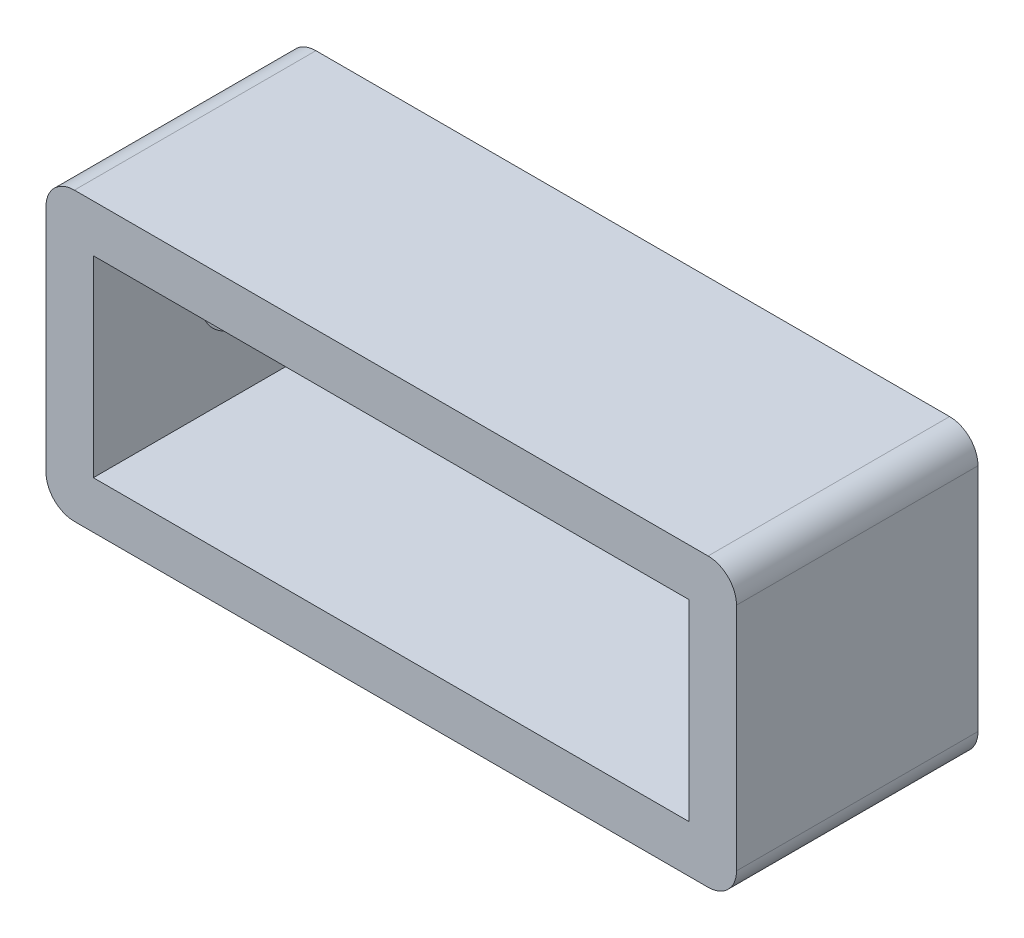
SolidWorks part; units mm, degrees
ref_plane "Front Plane" through (0, 0, 0) normal (0, 0, 1) x (1, 0, 0)
ref_plane "Top Plane" through (0, 0, 0) normal (0, 1, 0) x (1, 0, 0)
ref_plane "Right Plane" through (0, 0, 0) normal (1, 0, 0) x (0, 0, -1)
ref_plane "Plane1" through (0, 0, 0) normal (0, 0, -1) x (-1, 0, 0)
ref_plane "Plane2" through (0, 0, 3.8) normal (0, 0, -1) x (-1, 0, 0)
sketch "Sketch18" plane through (0, 0, 0) normal (0, 0, 1) x (1, 0, 0)
  line L1 (-23.75, 10) -> (4.75, 10)
  line L2 (-23.75, 10) -> (-23.75, -10)
  line L3 (-23.75, -10) -> (4.75, -10)
  line L4 (4.75, 10) -> (4.75, -10)
  line L5 (19.015, 8.6756) -> (31.985, 8.6756)
  line L6 (19.015, 8.6756) -> (19.015, -8.6756)
  line L7 (19.015, -8.6756) -> (31.985, -8.6756)
  line L8 (31.985, 8.6756) -> (31.985, -8.6756)
  line L11 (-35.9266, 0.5) -> (-35.9266, 33.5776)
  line L12 (0, 33.5776) -> (-35.9266, 33.5776)
  line L14 (-35.9266, 0.5) -> (-35.9266, -15)
  line L15 (-9.5, -15) -> (-35.9266, -15)
  line L16 (36.985, 0) -> (36.985, -15)
  line L17 (-9.5, -15) -> (36.985, -15)
  line L19 (-35.9266, 33.5776) -> (36.985, 33.5776)
  line L20 (-35.9266, 33.5776) -> (-35.9266, -15)
  line L21 (-35.9266, -15) -> (36.985, -15)
  line L22 (36.985, 33.5776) -> (36.985, -15)
  line L166 (31.985, -8.6756) -> (31.985, 8.6756)
  line L168 (19.015, 8.6756) -> (19.015, -8.6756)
  line L178 (4.75, 10) -> (-23.75, 10)
  line L190 (-23.75, -10) -> (4.75, -10)
  line L206 (4.75, -10) -> (4.75, 10)
  line L211 (-23.75, 10) -> (-23.75, -10)
  line L215 (31.985, -8.6756) -> (19.015, -8.6756)
  line L219 (19.015, 8.6756) -> (31.985, 8.6756)
  circle A0 centre (-17.9633, 25) radius 2.3
  circle A1 centre (10.5, 0.5) radius 1.4266
  circle A2 centre (-29.5, 0.5) radius 1.4266
  circle A4 centre (18.4925, 25) radius 2.3
extrude "Boss-Extrude1" add sketch "Sketch18" along normal blind 3 contours L22 L19 L12 L11 L14 L15 L17 L16 A4 A2 A1 A0 L1 L4 L3 L2 L5 L8 L7 L6
sketch "Sketch19" plane through (0, 0, 0) normal (0, 0, -1) x (-1, 0, 0)
  line L0 (-33.985, 10.3) -> (32.9266, 10.3)
  line L2 (32.9266, 10.3) -> (32.9266, -12)
  line L3 (9.5, -12) -> (32.9266, -12)
  line L4 (9.5, -12) -> (-33.985, -12)
  line L5 (9.5, -15) -> (-36.985, -15)
  line L6 (-36.985, 13.3) -> (-36.985, -15)
  line L7 (-33.985, 10.3) -> (-33.985, -12)
  line L9 (9.5, -15) -> (35.9266, -15)
  line L10 (35.9266, 13.3) -> (35.9266, -15)
  line L15 (-36.985, 13.3) -> (35.9266, 13.3)
  dimension "D1" = 3
extrude "Boss-Extrude3" add sketch "Sketch19" along normal blind 21
sketch "Sketch20" plane through (0, 0, 0) normal (0, 0, -1) x (-1, 0, 0)
  line L0 (-36.985, 13.3) -> (-36.985, 15.3)
  line L1 (-36.985, 33.5776) -> (-36.985, 13.3) construction
  line L2 (30.9266, 10.3) -> (30.9266, -10)
  line L3 (-36.985, 15.3) -> (35.9266, 15.3)
  line L4 (-36.985, 15.3) -> (-36.985, 13.3)
  line L5 (-36.985, 15.3) -> (35.9266, 15.3)
  line L6 (35.9266, 15.3) -> (35.9266, 13.3)
  line L7 (-36.985, 15.3) -> (35.9266, 15.3)
  line L8 (-36.985, 15.3) -> (-36.985, -15)
  line L9 (-36.985, -15) -> (35.9266, -15)
  line L10 (35.9266, 15.3) -> (35.9266, -15)
  line L11 (-36.985, 15.3) -> (-36.985, -15)
  line L12 (-36.985, -15) -> (35.9266, -15)
  line L13 (35.9266, 15.3) -> (35.9266, -15)
  line L14 (-31.985, 10.3) -> (30.9266, 10.3)
  line L15 (-31.985, 10.3) -> (-31.985, -10)
  line L16 (-31.985, -10) -> (30.9266, -10)
  line L17 (-31.985, 15.3) -> (-31.985, -15) construction
  line L18 (-36.985, 10.3) -> (35.9266, 10.3) construction
  line L19 (-36.985, -10) -> (35.9266, -10) construction
  line L20 (30.9266, 15.3) -> (30.9266, -15) construction
  dimension "D1" = 5
  dimension "D2" = 5
extrude "Boss-Extrude4" add sketch "Sketch20" along normal blind 21 contours L3 M6 M3 M4 | L10 L8 L9 L16 L15 L14 L2 M3
fillet "Fillet1" radius 3 6 edges at (36.985, 15.3, -10.5) (-35.9266, 15.3, -10.5) (-35.9266, -15, -9) (36.985, -15, -9) (36.985, 33.5776, 1.5) (-35.9266, 33.5776, 1.5)
sketch "Sketch23" plane through (0, 0, -21) normal (0, 0, -1) x (-1, 0, 0)
  line L0 (30.9266, 10.3) -> (-31.985, 10.3) construction
  line L1 (-31.985, 10.3) -> (-31.985, -10) construction
  line L2 (-31.985, -10) -> (30.9266, -10) construction
  line L3 (30.9266, 10.3) -> (30.9266, -10) construction
  line L4 (35.9266, -12) -> (35.9266, 12.3)
  line L5 (32.9266, 15.3) -> (-33.985, 15.3)
  line L6 (-36.985, 12.3) -> (-36.985, -12)
  line L7 (-33.985, -15) -> (32.9266, -15)
  line L8 (35.9266, -12) -> (35.9266, 12.3)
  line L9 (32.9266, 15.3) -> (-33.985, 15.3)
  line L10 (-36.985, 12.3) -> (-36.985, -12)
  line L11 (-33.985, -15) -> (32.9266, -15)
  line L12 (30.9266, 10.3) -> (-31.985, 10.3)
  line L13 (-31.985, 10.3) -> (-31.985, -10)
  line L14 (-31.985, -10) -> (30.9266, -10)
  line L15 (30.9266, 10.3) -> (30.9266, -10)
  arc A4 (35.9266, 12.3) -> (32.9266, 15.3) centre (32.9266, 12.3) ccw
  arc A5 (-33.985, 15.3) -> (-36.985, 12.3) centre (-33.985, 12.3) ccw
  arc A6 (-36.985, -12) -> (-33.985, -15) centre (-33.985, -12) ccw
  arc A7 (32.9266, -15) -> (35.9266, -12) centre (32.9266, -12) ccw
  arc A8 (35.9266, 12.3) -> (32.9266, 15.3) centre (32.9266, 12.3) ccw
  arc A9 (-33.985, 15.3) -> (-36.985, 12.3) centre (-33.985, 12.3) ccw
  arc A10 (-36.985, -12) -> (-33.985, -15) centre (-33.985, -12) ccw
  arc A11 (32.9266, -15) -> (35.9266, -12) centre (32.9266, -12) ccw
  dimension "D1" = 0
sketch "Sketch24" plane through (-35.9266, 0, 0) normal (-1, 0, 0) x (0, 0, 1)
  line L9 (-12.9375, 4.0023) -> (-12.9375, 4.15)
  circle A0 centre (-15.8063, 0.5352) radius 4.5
extrude "Cut-Extrude3" cut sketch "Sketch24" against normal blind 10 contours A0
extrude "Boss-Extrude7" add sketch "Sketch23" along normal blind 3
sketch "Sketch25" plane through (0, 0, -24) normal (0, 0, -1) x (-1, 0, 0)
  line L4 (35.9266, -12) -> (35.9266, 12.3)
  line L5 (32.9266, 15.3) -> (-33.985, 15.3)
  line L6 (-36.985, 12.3) -> (-36.985, -12)
  line L7 (-33.985, -15) -> (32.9266, -15)
  line L8 (35.9266, -12) -> (35.9266, 12.3)
  line L9 (32.9266, 15.3) -> (-33.985, 15.3)
  line L10 (-36.985, 12.3) -> (-36.985, -12)
  line L11 (-33.985, -15) -> (32.9266, -15)
  arc A4 (32.9266, -15) -> (35.9266, -12) centre (32.9266, -12) ccw
  arc A5 (35.9266, 12.3) -> (32.9266, 15.3) centre (32.9266, 12.3) ccw
  arc A6 (-33.985, 15.3) -> (-36.985, 12.3) centre (-33.985, 12.3) ccw
  arc A7 (-36.985, -12) -> (-33.985, -15) centre (-33.985, -12) ccw
  arc A8 (32.9266, -15) -> (35.9266, -12) centre (32.9266, -12) ccw
  arc A9 (35.9266, 12.3) -> (32.9266, 15.3) centre (32.9266, 12.3) ccw
  arc A10 (-33.985, 15.3) -> (-36.985, 12.3) centre (-33.985, 12.3) ccw
  arc A11 (-36.985, -12) -> (-33.985, -15) centre (-33.985, -12) ccw
  dimension "D1" = 0
extrude "Boss-Extrude8" add sketch "Sketch25" along normal blind 1.5
fillet "Fillet2" radius 2 1 edges at (25.5, 8.6756, 0)
fillet "Fillet3" radius 2 1 edges at (25.5, -8.6756, 0)
sketch "Sketch27" plane through (0, 0, 0) normal (0, 0, -1) x (-1, 0, 0)
  circle A1 centre (-18.4925, 25.3) radius 2.3
  circle A2 centre (17.4341, 25.3) radius 2.3
sketch "Sketch28" plane through (0, 0, 3) normal (0, 0, 1) x (1, 0, 0)
  circle A0 centre (-17.9633, 25) radius 2.3 construction
  circle A1 centre (18.4925, 25) radius 2.3 construction
  circle A2 centre (-17.9633, 25) radius 2.3
  circle A3 centre (18.4925, 25) radius 2.3
extrude "Boss-Extrude9" add sketch "Sketch28" against normal blind 3
extrude "Cut-Extrude4" cut sketch "Sketch27" against normal blind 3
sketch "Sketch29" plane through (36.985, 0, 0) normal (1, 0, 0) x (0, 0, -1)
  line L1 (0, 12.3) -> (-3, 12.3)
  line L2 (0, 12.3) -> (0, 33.5776)
  line L3 (0, 33.5776) -> (-3, 33.5776)
  line L4 (-3, 12.3) -> (-3, 33.5776)
  line L5 (0, 12.3) -> (-3, 12.3)
  line L6 (0, 12.3) -> (0, -15)
  line L7 (0, -15) -> (-3, -15)
  line L8 (-3, 12.3) -> (-3, -15)
extrude "Cut-Extrude5" cut sketch "Sketch29" against normal blind 77 contours L1 M4 M5 M6 | L4 L2 L3 M5 | L6 L1 M6 M1 | L8 L7 L6 M1
